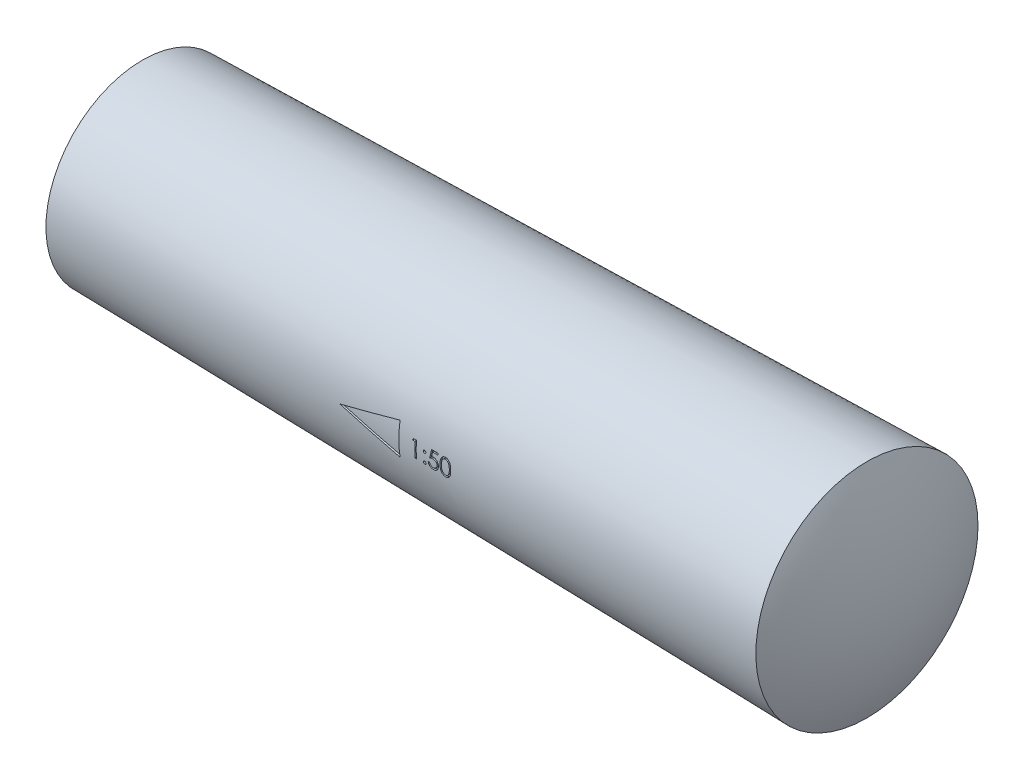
SolidWorks part; units mm, degrees
ref_plane "Front Plane" through (0, 0, 0) normal (0, 0, 1) x (1, 0, 0)
ref_plane "Top Plane" through (0, 0, 0) normal (0, 1, 0) x (1, 0, 0)
ref_plane "Right Plane" through (0, 0, 0) normal (1, 0, 0) x (0, 0, -1)
sketch "Sketch1" plane through (0, 0, 0) normal (1, 0, 0) x (0, 0, -1)
  circle A0 centre (0, 0) radius 6
  dimension "D1" = 12
extrude "Extrude1" add sketch "Sketch1" along normal mid plane 45
draft "Draft1" type of draft neutral plane draft angle 1.146 faces to draft 1 parameters "D1"=1.146
sketch "Sketch2" plane through (0, 0, 0) normal (0, 0, 1) x (1, 0, 0)
  line L0 (-22.5, 0) -> (-22.5, 6)
  line L1 (-22.5, 6) -> (-22.5, -6) construction
  line L2 (-22.5, 0) -> (-24.1, 0)
  line L3 (-24.1, 0) -> (-24.1, -6.45) construction
  line L4 (22.5, 0) -> (22.5, 6.9)
  line L5 (22.5, -6.9) -> (22.5, 6.9) construction
  line L6 (22.5, 0) -> (24.1, 0)
  line L7 (24.1, 0) -> (24.1, -6.45) construction
  line L8 (-22.5, -6) -> (22.5, -6.9) construction
  arc A0 (-24.1, 0) -> (-22.5, 6) centre (-12.05, 0) cw
  arc A1 (24.1, 0) -> (22.5, 6.9) centre (8.4217, 0) ccw
  point P14 (0, -6.45)
revolve "Revolve1" add sketch "Sketch2" angle 360 about L2
sketch "Sketch5" plane through (0, 0, 0) normal (0, 0, 1) x (1, 0, 0)
  line L0 (0, 6.45) -> (0, -6.45) construction
  line L1 (22.5, 6.9) -> (-22.5, 6) construction
  line L2 (-22.5, -6) -> (22.5, -6.9) construction
ref_plane "Plane2" through (0, 0, 0) normal (-0.02, 0, 0.9998) x (0.9998, 0, 0.02)
sketch "Sketch6" plane through (0, 0, 0) normal (-0.02, 0, 0.9998) x (0.9998, 0, 0.02)
  line L0 (0, 0) -> (0, 1)
  line L1 (0, 6.45) -> (0, -6.45) construction
  line L2 (0, 1) -> (-3.7321, 0)
  line L3 (-3.7321, 0) -> (0, -1)
  line L4 (0, -1) -> (0, 0)
  line L5 (0, -0.5) -> (4, -0.5) construction
  text T0 "1:50" font "Century Gothic" height 1
  dimension "D1" = 2
  dimension "D2" = 30
  dimension "D3" = 4
wrap "Wrap2" sketch "Sketch6" wrap type deboss source sketch "Sketch6" thickness 0.1 parameters "D1"=0.1
equation "\"D2@Sketch2\" = \"D1@Sketch2\""
